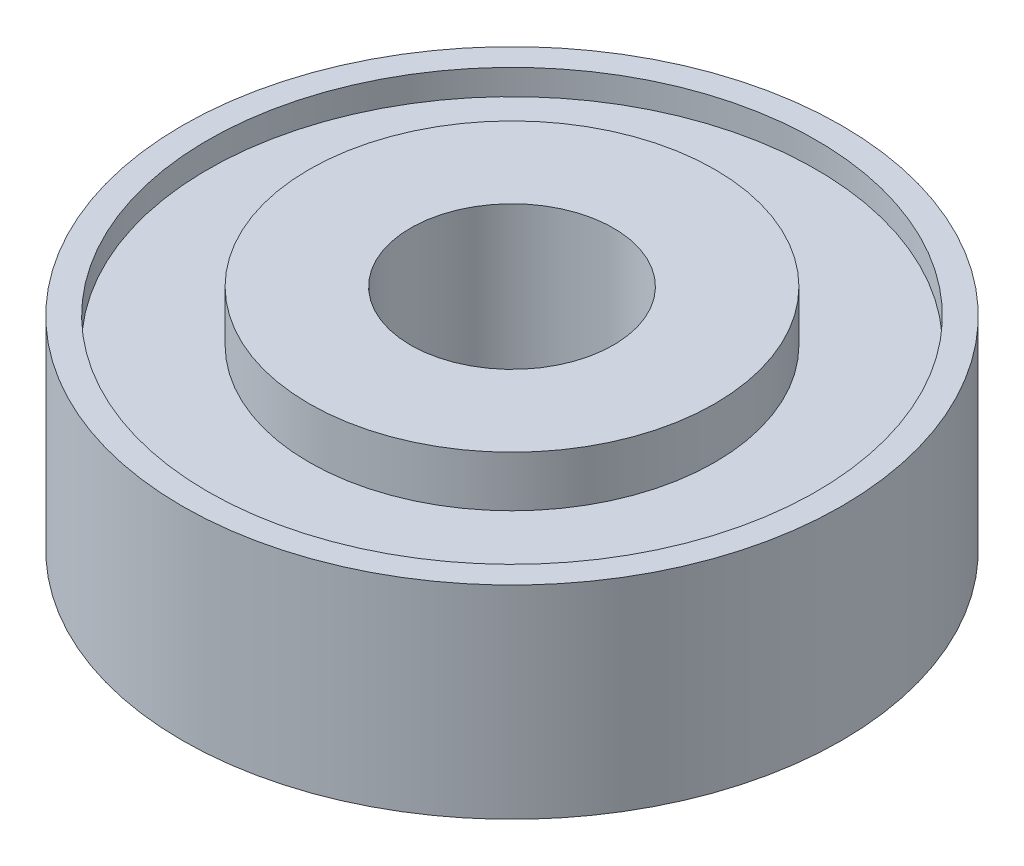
SolidWorks part; units mm, degrees
ref_plane "前视基准面" through (0, 0, 0) normal (0, 0, 1) x (1, 0, 0)
ref_plane "上视基准面" through (0, 0, 0) normal (0, 1, 0) x (1, 0, 0)
ref_plane "右视基准面" through (0, 0, 0) normal (1, 0, 0) x (0, 0, -1)
imported_body "输入1"
other "移动面1" parameters "D1"=0.5
equation "\"Dummy1\"= \"零件图号代码\""
equation "\"Dummy2\"= \"产品名称代码\""
